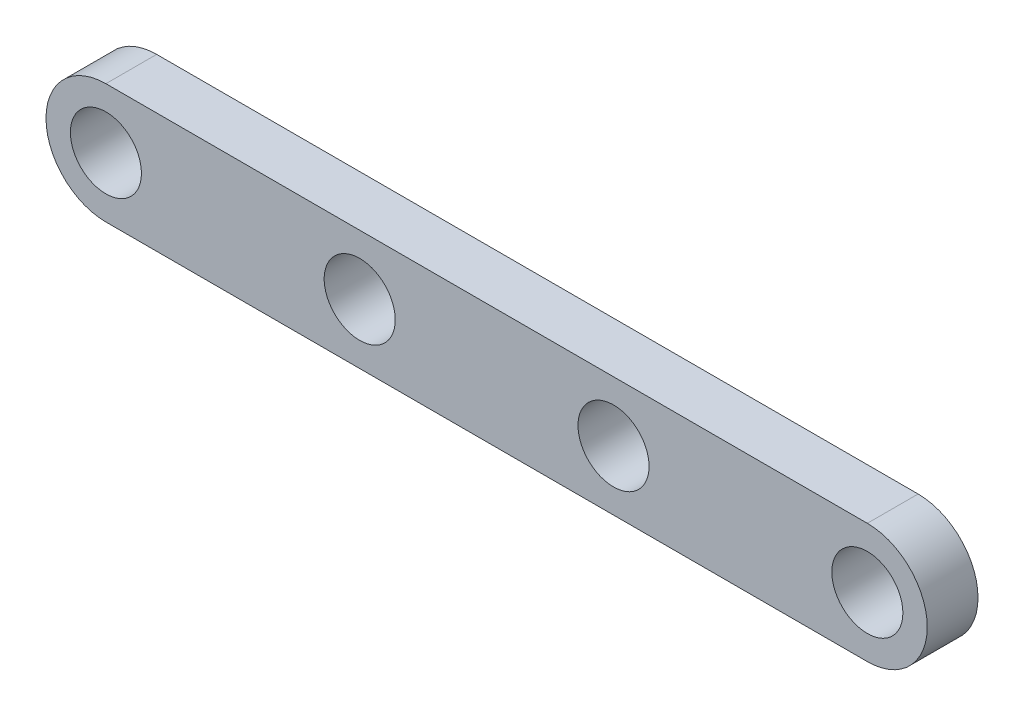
SolidWorks part; units mm, degrees
ref_plane "Front" through (0, 0, 0) normal (0, 0, 1) x (1, 0, 0)
ref_plane "Top" through (0, 0, 0) normal (0, 1, 0) x (1, 0, 0)
ref_plane "Right" through (0, 0, 0) normal (1, 0, 0) x (0, 0, -1)
sketch "Sketch1" plane through (0, 0, 0) normal (0, 0, 1) x (1, 0, 0)
  line L0 (261.5379, 54.2991) -> (223.4379, 54.2991)
  line L1 (261.5379, 48.3047) -> (223.4379, 48.3047)
  circle A0 centre (223.4379, 51.3019) radius 1.778
  circle A1 centre (236.1379, 51.3019) radius 1.778
  circle A2 centre (248.8379, 51.3019) radius 1.778
  circle A3 centre (261.5379, 51.3019) radius 1.778
  arc A4 (223.4379, 54.2991) -> (223.4379, 48.3047) centre (223.4379, 51.3019) ccw
  arc A5 (261.5379, 48.3047) -> (261.5379, 54.2991) centre (261.5379, 51.3019) ccw
extrude "Boss-Extrude1" add sketch "Sketch1" along normal blind 2.54 contours L0 A4 L1 A5
sketch "Sketch3" plane through (0, 0, 0) normal (0, 0, 1) x (1, 0, 0)
  circle A1 centre (223.4379, 51.3019) radius 1.778
  circle A2 centre (236.1379, 51.3019) radius 1.778
  circle A3 centre (248.8379, 51.3019) radius 1.778
  circle A4 centre (261.5379, 51.3019) radius 1.778
extrude "Cut-Extrude2" cut sketch "Sketch3" along normal through all
